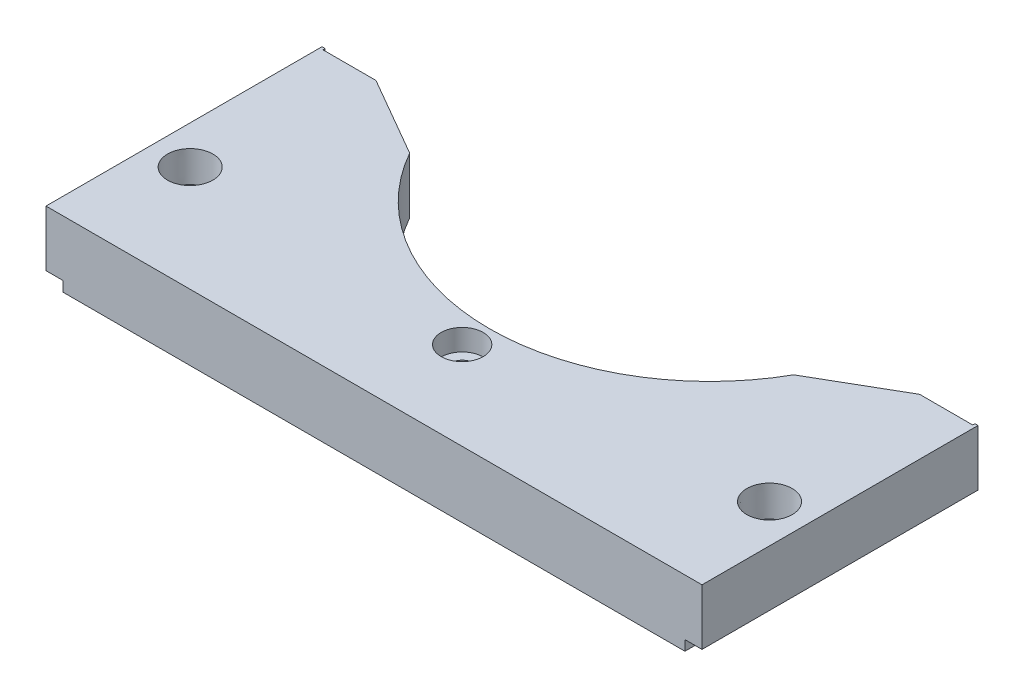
SolidWorks part; units mm, degrees
ref_plane "Front" through (0, 0, 0) normal (0, 0, 1) x (1, 0, 0)
ref_plane "Top" through (0, 0, 0) normal (0, 1, 0) x (1, 0, 0)
ref_plane "Right" through (0, 0, 0) normal (1, 0, 0) x (0, 0, -1)
sketch "Sketch3" plane through (0, 0, 0) normal (0, 1, 0) x (1, 0, 0)
  line L0 (0, 0) -> (0, 31.056) construction
  line L1 (-73.7175, 31.056) -> (73.7175, 31.056)
  line L2 (-73.7175, 31.056) -> (-73.7175, -31.056)
  line L3 (-73.7175, -31.056) -> (73.7175, -31.056)
  line L4 (73.7175, 31.056) -> (73.7175, -31.056)
  line L5 (0, 0) -> (73.7175, 0) construction
  dimension "D1" = 147.435
  dimension "D2" = 62.112
extrude "Extrude1" add sketch "Sketch3" along normal blind 12.7
sketch "Sketch4" plane through (0, 12.7, 0) normal (0, 1, 0) x (1, 0, 0)
  line L1 (-50, 45.1435) -> (50, 45.1435)
  line L2 (0, 31.056) -> (0, 45.1435) construction
  line L3 (73.7175, 31.056) -> (-73.7175, 31.056) construction
  arc A0 (-50, 45.1435) -> (50, 45.1435) centre (0, 45.1435) ccw
  dimension "D1" = 50
  dimension "D2" = 14.0875
extrude "Extrude2" cut sketch "Sketch4" against normal up to next
sketch "Sketch9" plane through (0, 12.7, 0) normal (0, 1, 0) x (1, 0, 0)
  line L0 (-61.673, 31.056) -> (0, -4.5509)
  line L1 (-47.9744, 31.056) -> (-73.7175, 31.056) construction
  line L2 (0, -4.5509) -> (61.673, 31.056)
  line L3 (73.7175, 31.056) -> (47.9744, 31.056) construction
  line L4 (61.673, 31.056) -> (-61.673, 31.056)
  line L5 (0, 0) -> (0, -4.5509) construction
  line L6 (0, -4.5509) -> (0, 31.056) construction
  line L7 (-73.7175, 31.056) -> (-73.7175, -31.056) construction
  dimension "D1" = 12.0445
  dimension "D2" = 120
extrude "Extrude6" cut sketch "Sketch9" against normal up to next
sketch "Sketch6" plane through (0, 0, 0) normal (0, -1, 0) x (1, 0, 0)
  line L5 (-73.7175, 31.056) -> (73.7175, 31.056) construction
  line L6 (-70.5425, 31.056) -> (70.5425, 31.056)
  line L10 (-70.5425, -27.881) -> (-62.5238, -27.881)
  line L11 (62.5238, -27.881) -> (70.5425, -27.881)
  line L12 (70.5425, -27.881) -> (70.5425, 27.881)
  line L13 (70.5425, 27.881) -> (-70.5425, 27.881)
  line L14 (-70.5425, 27.881) -> (-70.5425, -27.881)
  line L15 (-70.5425, -27.881) -> (-62.5238, -27.881)
  line L16 (62.5238, -27.881) -> (70.5425, -27.881)
  line L17 (70.5425, -27.881) -> (70.5425, 31.056)
  line L19 (-70.5425, 31.056) -> (-70.5425, -27.881)
  line L23 (45.8885, -18.2766) -> (62.5238, -27.881)
  line L24 (45.8885, -18.2766) -> (62.5238, -27.881)
  line L25 (-62.5238, -27.881) -> (-45.8885, -18.2766)
  line L26 (-62.5238, -27.881) -> (-45.8885, -18.2766)
  arc A2 (45.8885, -18.2766) -> (-45.8885, -18.2766) centre (0, -45.1435) ccw
  arc A3 (45.8885, -18.2766) -> (-45.8885, -18.2766) centre (0, -45.1435) ccw
  dimension "D1" = 3.175
extrude "Extrude4" add sketch "Sketch6" along normal blind 2.3
sketch "Sketch7" plane through (0, -2.3, 0) normal (0, -1, 0) x (1, 0, 0)
  line L1 (47.625, 5.657) -> (47.625, -31.056)
  line L2 (-53.975, 5.657) -> (-53.975, -31.056)
  line L3 (-53.975, -31.056) -> (-47.625, -31.056)
  line L4 (-47.625, 5.657) -> (-47.625, -31.056)
  line L5 (-61.673, -31.056) -> (-73.7175, -31.056) construction
  line L6 (0, 0) -> (0, 42.9718) construction
  line L7 (53.975, -31.056) -> (47.625, -31.056)
  line L8 (53.975, 5.657) -> (53.975, -31.056)
  arc A0 (-53.975, 5.657) -> (-47.625, 5.657) centre (-50.8, 5.657) cw
  arc A1 (53.975, 5.657) -> (47.625, 5.657) centre (50.8, 5.657) ccw
  dimension "D2" = 3.175
  dimension "D1" = 101.6
  dimension "D3" = 5.657
extrude "Extrude5" cut sketch "Sketch7" against normal up to surface (2.3 mm away)
hole_wizard "CBORE for #10 Socket Head Cap Screw1" positions "3DSketch1" profile "Sketch8" counterbore size "#10" standard "Ansi Inch"
sketch3d "3DSketch1"
  line L0 (0, 12.7, 31.056) -> (0, 12.7, 11.056) construction
  line L1 (-73.7175, 12.7, 31.056) -> (73.7175, 12.7, 31.056) construction
  point P0 (0, 12.7, 11.056)
  dimension "D1" = 20
sketch "Sketch8" plane through (0, 12.7, 11.056) normal (1, 0, 0) x (0, 0, 1)
  line L0 (0, 0) -> (0, 15)
  line L1 (0, 15) -> (2.4892, 15)
  line L3 (2.4892, 15) -> (2.4892, 4.826)
  line L4 (2.4892, 4.826) -> (4.7625, 4.826)
  line L5 (4.7625, 4.826) -> (4.7625, 0)
  line L7 (4.7625, 0) -> (0, 0)
  line L11 (0, -6.35) -> (0, 107.95) construction
  dimension "Thru Hole Dia." = 4.9784
  dimension "Thru Hole Depth" = 15
  dimension "C'Bore Dia." = 9.525
  dimension "C'Bore Depth" = 4.826
sketch "Sketch10" plane through (0, 0, -31.056) normal (0, 0, -1) x (-1, 0, 0)
  line L0 (-73.7175, 0) -> (-61.673, 0) construction
  line L2 (-71.7175, 6.35) -> (-71.7175, 0) construction
  line L4 (-73.7175, 12.7) -> (-73.7175, 0) construction
  line L5 (-73.7175, 6.35) -> (-71.7175, 6.35) construction
  line L7 (-70.7462, 0) -> (-72.6888, 0)
  line L8 (-70.968, 6.35) -> (-70.7462, 0)
  line L9 (-72.4671, 6.35) -> (-72.6888, 0)
  arc A0 (-72.4671, 6.35) -> (-70.968, 6.35) centre (-71.7175, 6.3238) cw
  dimension "D2" = 0.75
  dimension "D1" = 2
  dimension "D3" = 4
extrude "Extrude7" cut sketch "Sketch10" against normal blind 1
sketch "Sketch11" plane through (0, 0, -31.056) normal (0, 0, -1) x (-1, 0, 0)
  line L0 (-68.3238, 11.9) -> (-67.0668, 11.9)
  line L1 (-69.1175, 11.1062) -> (-69.1175, 10.5806)
  line L2 (-66.273, 11.1062) -> (-66.273, 10.5806)
  line L3 (-70.4453, 8.4373) -> (-70.4453, 4.2627)
  line L4 (-73.7175, 0) -> (-61.673, 0) construction
  line L5 (-64.9453, 8.4373) -> (-64.9453, 4.2627)
  line L6 (-67.6953, 6.35) -> (-70.4453, 6.35) construction
  line L7 (-67.6953, 12.7) -> (-67.6953, 6.35) construction
  line L8 (-73.7175, 12.7) -> (-61.673, 12.7) construction
  line L9 (-61.673, 6.35) -> (-67.6953, 6.35) construction
  line L10 (-61.673, 0) -> (-61.673, 12.7) construction
  line L11 (-66.273, 1.5937) -> (-66.273, 2.1194)
  line L12 (-68.3238, 0.8) -> (-67.0668, 0.8)
  line L13 (-69.1175, 1.5937) -> (-69.1175, 2.1194)
  line L14 (-61.673, 12.7) -> (-73.7175, 12.7) construction
  arc A0 (-70.005, 9.148) -> (-69.1175, 10.5806) centre (-70.7175, 10.5806) ccw
  arc A1 (-65.3855, 9.148) -> (-66.273, 10.5806) centre (-64.673, 10.5806) cw
  arc A2 (-65.3855, 3.552) -> (-66.273, 2.1194) centre (-64.673, 2.1194) ccw
  arc A3 (-70.005, 3.552) -> (-69.1175, 2.1194) centre (-70.7175, 2.1194) cw
  arc A4 (-68.3238, 11.9) -> (-69.1175, 11.1062) centre (-68.3238, 11.1062) ccw
  arc A5 (-66.273, 11.1062) -> (-67.0668, 11.9) centre (-67.0668, 11.1062) ccw
  arc A6 (-70.005, 9.148) -> (-70.4453, 8.4373) centre (-69.6515, 8.4373) ccw
  arc A7 (-64.9453, 8.4373) -> (-65.3855, 9.148) centre (-65.739, 8.4373) ccw
  arc A8 (-70.005, 3.552) -> (-70.4453, 4.2627) centre (-69.6515, 4.2627) cw
  arc A9 (-64.9453, 4.2627) -> (-65.3855, 3.552) centre (-65.739, 4.2627) cw
  arc A10 (-68.3238, 0.8) -> (-69.1175, 1.5937) centre (-68.3238, 1.5937) cw
  arc A11 (-66.273, 1.5937) -> (-67.0668, 0.8) centre (-67.0668, 1.5937) cw
  point P4 (-67.6953, 11.9)
  point P28 (-64.9453, 6.35)
  point P32 (-69.1175, 11.9)
  point P35 (-66.273, 11.9)
  point P38 (-70.4453, 9.0039)
  point P41 (-64.9453, 9.0039)
  point P44 (-70.4453, 3.6961)
  point P47 (-64.9453, 3.6961)
  point P50 (-69.1175, 0.8)
  point P53 (-66.273, 0.8)
  dimension "D1" = 3.2
  dimension "D4" = 6.0445
  dimension "D6" = 0.7937
  dimension "D2" = 0.8
  dimension "D3" = 5.5
  dimension "D5" = 8.4612
  dimension "D7" = 12.0445
extrude "Extrude8" cut sketch "Sketch11" against normal blind 0.5
hole_wizard "1/8 (0.125) Diameter Hole1" positions "3DSketch2" profile "Sketch12" hole size "1/8" standard "Ansi Inch"
sketch3d "3DSketch2"
  line L0 (73.7175, 12.7, -31.056) -> (61.673, 12.7, -31.056) construction
  line L1 (73.7175, 12.7, -31.056) -> (73.7175, 0, -31.056) construction
  point P0 (67.6937, 3.2132, -30.556)
  dimension "D1" = 9.5
  dimension "D2" = 6.0445
sketch "Sketch12" plane through (67.6937, 3.2132, -30.556) normal (1, 0, 0) x (0, 1, 0)
  line L0 (0, 0) -> (0, 39.0539)
  line L1 (0, 39.0539) -> (1.5875, 38.1)
  line L2 (1.5875, 38.1) -> (1.5875, 0)
  line L5 (1.5875, 0) -> (0, 0)
  line L10 (0, 39.0539) -> (-1.5875, 38.1) construction
  line L11 (0, -6.35) -> (0, 107.95) construction
  dimension "Hole Dia." = 3.175
  dimension "Hole Depth" = 38.1
  dimension "Drill Angle" = 118
hole_wizard "1/8 NPT Tapped Hole1" positions "3DSketch3" profile "Sketch13" size "1/8" standard "Ansi Inch"
sketch3d "3DSketch3"
  line L0 (73.7175, 12.7, 31.056) -> (73.7175, 12.7, -31.056) construction
  line L1 (73.7175, 12.7, -31.056) -> (61.673, 12.7, -31.056) construction
  point P0 (65.7175, 12.7, 7.044)
  dimension "D1" = 8
  dimension "D2" = 38.1
sketch "Sketch13" plane through (65.7175, 12.7, 7.044) normal (1, 0, 0) x (0, 0, 1)
  line L0 (0, 0) -> (0, 14.1535)
  line L1 (4.2164, 11.62) -> (0, 14.1535)
  line L2 (-4.2164, 11.62) -> (0, 14.1535) construction
  line L3 (4.2164, 11.62) -> (4.2164, 6.92)
  line L4 (4.2164, 6.92) -> (4.9362, 6.92)
  line L5 (4.9362, 6.92) -> (5.1434, 0)
  line L6 (-4.9362, 6.92) -> (-5.1434, 0) construction
  line L7 (5.1434, 0) -> (0, 0)
  line L8 (0, -6.35) -> (0, 107.95) construction
  line L11 (-4.2164, 6.92) -> (-4.9362, 6.92) construction
  dimension "Tap Drill Dia." = 8.4328
  dimension "Tap Drill Depth" = 11.62
  dimension "Thread Dia." = 10.2867
  dimension "Thread Angle" = 3.43
  dimension "Thread Depth" = 6.92
  dimension "Drill Angle" = 118
sketch "Sketch14" plane through (73.7175, 0, 0) normal (1, 0, 0) x (0, 0, -1)
  line L0 (27.881, 0) -> (-31.056, 0) construction
  line L1 (-31.056, 12.7) -> (31.556, 12.7)
  line L2 (-31.056, 12.7) -> (-31.056, 0)
  line L3 (-31.056, 0) -> (31.556, 0)
  line L4 (31.556, 12.7) -> (31.556, 0)
  line L5 (31.056, 12.7) -> (31.056, 0) construction
  dimension "D1" = 0.5
extrude "Extrude10" add sketch "Sketch14" along normal blind 0.7
mirror "Mirror1" about plane through (0, 0, 0) normal (1, 0, 0) of "Extrude7", "Extrude8", "1/8 (0.125) Diameter Hole1", "1/8 NPT Tapped Hole1", "Extrude10"
sketch "Sketch15" plane through (0, -2.3, 0) normal (0, -1, 0) x (1, 0, 0)
  line L13 (47.625, -19.2792) -> (47.625, 5.657)
  line L14 (53.975, 5.657) -> (53.975, -22.9454)
  line L15 (53.975, -22.9454) -> (62.5238, -27.881)
  line L16 (62.5238, -27.881) -> (70.5425, -27.881)
  line L17 (70.5425, -27.881) -> (70.5425, 31.056)
  line L18 (70.5425, 31.056) -> (-70.5425, 31.056)
  line L19 (-70.5425, 31.056) -> (-70.5425, -27.881)
  line L20 (-70.5425, -27.881) -> (-62.5238, -27.881)
  line L21 (-62.5238, -27.881) -> (-53.975, -22.9454)
  line L22 (-53.975, -22.9454) -> (-53.975, 5.657)
  line L23 (-47.625, 5.657) -> (-47.625, -19.2792)
  line L24 (-47.625, -19.2792) -> (-45.8885, -18.2766)
  line L25 (45.8885, -18.2766) -> (47.625, -19.2792)
  line L26 (47.625, -19.2792) -> (47.625, 5.657)
  line L27 (53.975, 5.657) -> (53.975, -22.9454)
  line L28 (53.975, -22.9454) -> (62.5238, -27.881)
  line L29 (62.5238, -27.881) -> (70.5425, -27.881)
  line L30 (70.5425, -27.881) -> (70.5425, 31.056)
  line L31 (70.5425, 31.056) -> (-70.5425, 31.056)
  line L32 (-70.5425, 31.056) -> (-70.5425, -27.881)
  line L33 (-70.5425, -27.881) -> (-62.5238, -27.881)
  line L34 (-62.5238, -27.881) -> (-53.975, -22.9454)
  line L35 (-53.975, -22.9454) -> (-53.975, 5.657)
  line L36 (-47.625, 5.657) -> (-47.625, -19.2792)
  line L37 (-47.625, -19.2792) -> (-45.8885, -18.2766)
  line L38 (45.8885, -18.2766) -> (47.625, -19.2792)
  circle A0 centre (0, 11.056) radius 2.4892 construction
  circle A1 centre (0, 11.056) radius 2.4892
  arc A3 (53.975, 5.657) -> (47.625, 5.657) centre (50.8, 5.657) ccw
  arc A4 (-47.625, 5.657) -> (-53.975, 5.657) centre (-50.8, 5.657) ccw
  arc A5 (45.8885, -18.2766) -> (-45.8885, -18.2766) centre (0, -45.1435) ccw
  arc A6 (53.975, 5.657) -> (47.625, 5.657) centre (50.8, 5.657) ccw
  arc A7 (-47.625, 5.657) -> (-53.975, 5.657) centre (-50.8, 5.657) ccw
  arc A8 (45.8885, -18.2766) -> (-45.8885, -18.2766) centre (0, -45.1435) ccw
  dimension "D1" = 0
extrude "Extrude11" [suppressed] add sketch "Sketch15" along normal blind 4.7574
sketch "Sketch16" [suppressed] plane through (0, 0, 0) normal (0, -1, 0) x (1, 0, 0)
  line L13 (45.8885, -18.2766) -> (47.625, -19.2792)
  line L14 (47.625, -19.2792) -> (47.625, 5.657)
  line L15 (53.975, 5.657) -> (53.975, -22.9454)
  line L16 (53.975, -22.9454) -> (62.5238, -27.881)
  line L17 (62.5238, -27.881) -> (70.5425, -27.881)
  line L18 (70.5425, -27.881) -> (70.5425, 31.056)
  line L19 (70.5425, 31.056) -> (-70.5425, 31.056)
  line L20 (-70.5425, 31.056) -> (-70.5425, -27.881)
  line L21 (-70.5425, -27.881) -> (-62.5238, -27.881)
  line L22 (-62.5238, -27.881) -> (-53.975, -22.9454)
  line L23 (-53.975, -22.9454) -> (-53.975, 5.657)
  line L24 (-47.625, 5.657) -> (-47.625, -19.2792)
  line L25 (-47.625, -19.2792) -> (-45.8885, -18.2766)
  line L29 (45.8885, -18.2766) -> (62.5238, -27.881)
  line L30 (62.5238, -27.881) -> (70.5425, -27.881)
  line L31 (70.5425, -27.881) -> (70.5425, 31.056)
  line L32 (70.5425, 31.056) -> (-70.5425, 31.056)
  line L33 (-70.5425, 31.056) -> (-70.5425, -27.881)
  line L34 (-70.5425, -27.881) -> (-62.5238, -27.881)
  line L35 (-62.5238, -27.881) -> (-45.8885, -18.2766)
  arc A3 (53.975, 5.657) -> (47.625, 5.657) centre (50.8, 5.657) ccw
  arc A4 (-47.625, 5.657) -> (-53.975, 5.657) centre (-50.8, 5.657) ccw
  arc A5 (45.8885, -18.2766) -> (-45.8885, -18.2766) centre (0, -45.1435) ccw
  arc A8 (45.8885, -18.2766) -> (-45.8885, -18.2766) centre (0, -45.1435) ccw
  dimension "D1" = 0
extrude "Extrude12" [suppressed] add sketch "Sketch16" along normal blind 4.7574
